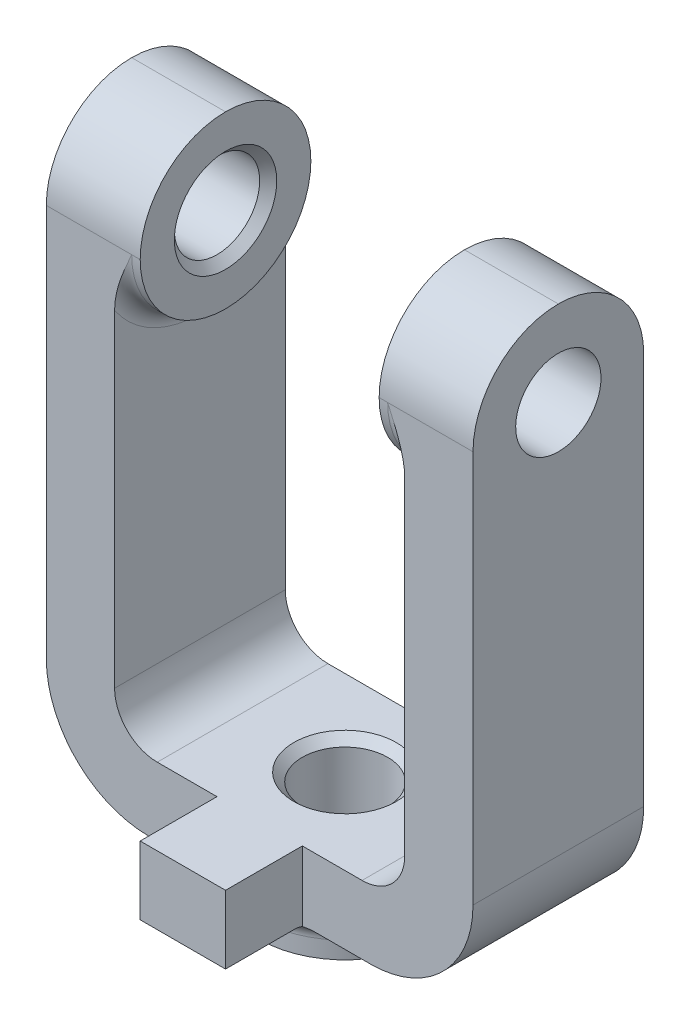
SolidWorks part; units mm, degrees
ref_plane "Front Plane" through (0, 0, 0) normal (0, 0, 1) x (1, 0, 0)
ref_plane "Top Plane" through (0, 0, 0) normal (0, 1, 0) x (1, 0, 0)
ref_plane "Right Plane" through (0, 0, 0) normal (1, 0, 0) x (0, 0, -1)
sketch "Sketch1" plane through (0, 0, 0) normal (0, 0, 1) x (1, 0, 0)
  line L0 (0, 0) -> (0, 33.1977)
  line L1 (0, 33.1977) -> (-3, 33.1977)
  line L2 (-3, 33.1977) -> (-3, 53.1977)
  line L3 (-3, 53.1977) -> (8, 53.1977)
  line L4 (8, 53.1977) -> (8, -14.8023)
  line L5 (8, -14.8023) -> (-7, -14.8023)
  line L6 (-7, -14.8023) -> (-7, -18.8023)
  line L7 (-7, -18.8023) -> (-17, -18.8023)
  line L8 (-17, -18.8023) -> (-17, -6.8023)
  line L9 (-17, -6.8023) -> (0, -6.8023)
  line L10 (0, -6.8023) -> (0, 0)
  dimension "D1" = 11
  dimension "D2" = 20
  dimension "D3" = 68
  dimension "D4" = 3
  dimension "D5" = 8
  dimension "D6" = 4
  dimension "D7" = 25
  dimension "D8" = 10
  dimension "D9" = 4
extrude "Boss-Extrude1" add sketch "Sketch1" along normal blind 20
fillet "Fillet1" radius 5 1 edges at (0, -6.8023, 10)
fillet "Fillet2" radius 12 1 edges at (8, -14.8023, 10)
fillet "Fillet6" radius 10 6 edges at (2.5, 53.1977, 0) (2.5, 53.1977, 20) (-1.5, 33.1977, 0) (-1.5, 33.1977, 20) (-7, -16.8023, 0) (-7, -16.8023, 20)
sketch "Sketch2" plane through (0, 0, 20) normal (0, 0, 1) x (1, 0, 0)
  line L0 (-5, -6.8023) -> (-17, -6.8023) construction
  line L1 (-17, -14.8023) -> (-12, -14.8023)
  line L2 (-17, -14.8023) -> (-17, -6.8023)
  line L3 (-17, -6.8023) -> (-12, -6.8023)
  line L4 (-12, -14.8023) -> (-12, -6.8023)
  dimension "D1" = 8
  dimension "D2" = 5
extrude "Boss-Extrude2" add sketch "Sketch2" along normal blind 9
fillet "Fillet10" radius 2 4 edges at (0, 36.1266, 17.0711) (0, 36.1266, 2.9289) (-9.9289, -14.8023, 17.0711) (-9.9289, -14.8023, 2.9289)
sketch "Sketch4" plane through (-3, 0, 0) normal (-1, 0, 0) x (0, 0, 1)
  line L0 (0, 43.1977) -> (22.7287, 43.1977) construction
  line L1 (10, 56.4479) -> (10, 29.0629) construction
  circle A0 centre (10, 43.1977) radius 10 construction
  circle A1 centre (10, 43.1977) radius 5
  dimension "D1" = 10
extrude "Cut-Extrude1" cut sketch "Sketch4" against normal blind 20
sketch "Sketch5" plane through (0, -18.8023, 0) normal (0, -1, 0) x (1, 0, 0)
  line L0 (-8.5652, 10) -> (-24.113, 10) construction
  line L1 (-17, 20) -> (-17, 0) construction
  circle A0 centre (-17, 10) radius 5
  dimension "D1" = 10
extrude "Cut-Extrude2" cut sketch "Sketch5" against normal blind 20
chamfer "Chamfer1" distance 1 angle 45 3 edges at (-3, 43.1977, 15) (-12, -18.8023, 10) (-12, -6.8023, 10)
mirror "Mirror7" about plane through (-17, -18.8023, 20) normal (1, 0, 0)
